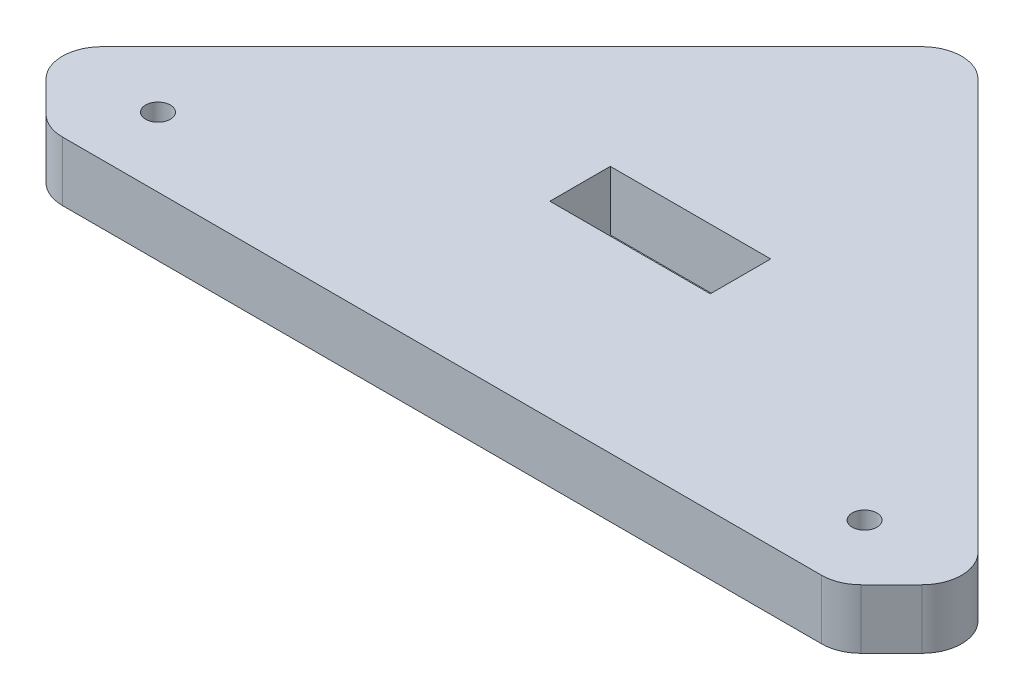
SolidWorks part; units mm, degrees
ref_plane "Ön Düzlem" through (0, 0, 0) normal (0, 0, 1) x (1, 0, 0)
ref_plane "Üst Düzlem" through (0, 0, 0) normal (0, 1, 0) x (1, 0, 0)
ref_plane "Sağ Düzlem" through (0, 0, 0) normal (1, 0, 0) x (0, 0, -1)
sketch "Çizim1" plane through (0, 0, 0) normal (0, 1, 0) x (1, 0, 0)
  line L0 (-40, 0) -> (40, 0)
  line L1 (-40, 0) -> (-47.0711, 7.0711)
  line L2 (40, 0) -> (47.0711, 7.0711)
  line L3 (-47.0711, 7.0711) -> (0, 54.1421)
  line L4 (0, 0) -> (0, 54.1421) construction
  line L5 (47.0711, 7.0711) -> (0, 54.1421)
  line L7 (-8.1, 25.1) -> (8.1, 25.1)
  line L8 (-8.1, 25.1) -> (-8.1, 19)
  line L9 (-8.1, 19) -> (8.1, 19)
  line L10 (8.1, 25.1) -> (8.1, 19)
  line L11 (-8.1, 25.1) -> (8.1, 19) construction
  line L12 (-8.1, 19) -> (8.1, 25.1) construction
  circle A0 centre (-35.6863, 7) radius 1.25
  circle A1 centre (35.6863, 7) radius 1.25
  point P4 (0, 0)
  point P12 (0, 22.05)
  dimension "D8" = 2.5
  dimension "D9" = 2.5
  dimension "D10" = 7
  dimension "D11" = 8
  dimension "D12" = 7
  dimension "D13" = 8
  dimension "D1" = 80
  dimension "D2" = 135
  dimension "D3" = 135
  dimension "D4" = 10
  dimension "D5" = 10
  dimension "D6" = 90
  dimension "D7" = 66.5685
  dimension "D14" = 19
  dimension "D15" = 6.1
  dimension "D16" = 16.2
extrude "Yükseklik-Ekstrüzyon1" add sketch "Çizim1" along normal blind 6
fillet "Radyus1" radius 4 5 edges at (-47.0711, 3, -7.0711) (-40, 3, 0) (0, 3, -54.1421) (47.0711, 3, -7.0711) (40, 3, 0)
